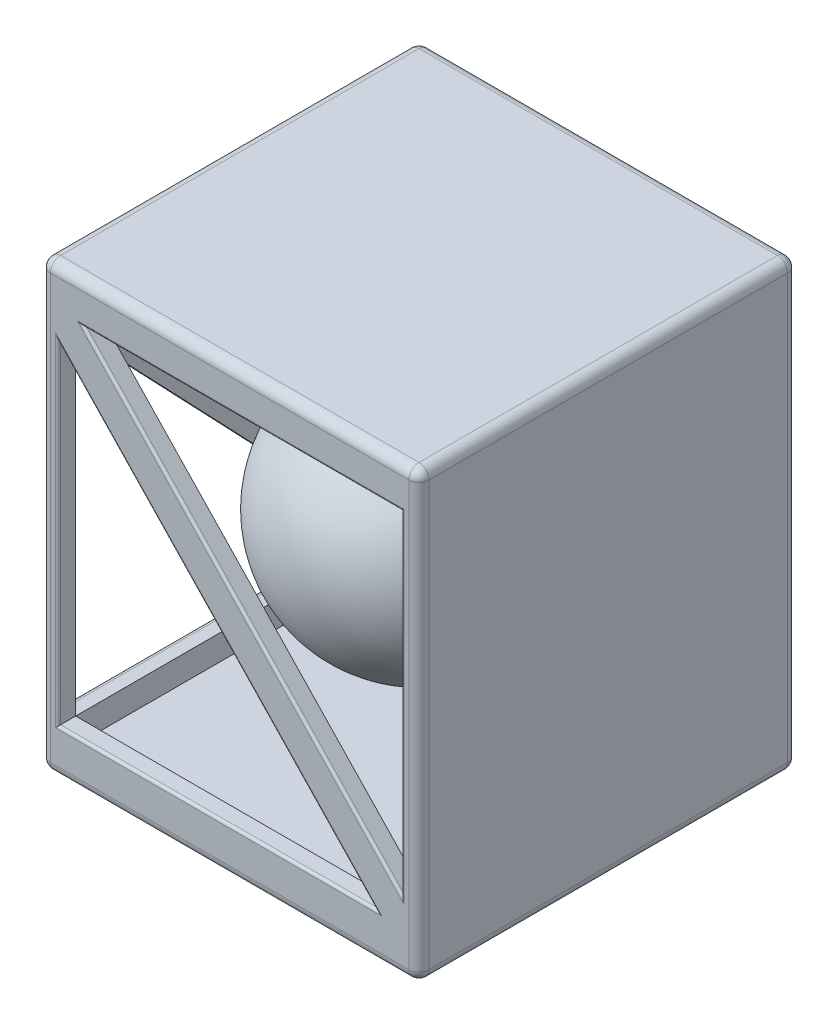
SolidWorks part; units mm, degrees
ref_plane "Front Plane" through (0, 0, 0) normal (0, 0, 1) x (1, 0, 0)
ref_plane "Top Plane" through (0, 0, 0) normal (0, 1, 0) x (1, 0, 0)
ref_plane "Right Plane" through (0, 0, 0) normal (1, 0, 0) x (0, 0, -1)
sketch "Sketch5" plane through (0, 0, 0) normal (0, 1, 0) x (1, 0, 0)
  line L1 (-37.5, 37.5) -> (37.5, 37.5)
  line L2 (-37.5, 37.5) -> (-37.5, -37.5)
  line L3 (-37.5, -37.5) -> (37.5, -37.5)
  line L4 (37.5, 37.5) -> (37.5, -37.5)
  line L5 (-37.5, 37.5) -> (37.5, -37.5) construction
  line L6 (-37.5, -37.5) -> (37.5, 37.5) construction
  point P0 (0, 0)
  dimension "D1" = 75
  dimension "D2" = 75
extrude "Boss-Extrude5" add sketch "Sketch5" along normal blind 4
sketch "Sketch6" plane through (0, 4, 0) normal (0, 1, 0) x (1, 0, 0)
  line L1 (-37.5, 37.5) -> (37.5, 37.5)
  line L2 (-37.5, 37.5) -> (-37.5, -37.5)
  line L3 (-37.5, -37.5) -> (37.5, -37.5)
  line L4 (37.5, 37.5) -> (37.5, -37.5)
  line L5 (-37.5, 37.5) -> (37.5, -37.5) construction
  line L6 (-37.5, -37.5) -> (37.5, 37.5) construction
  line L7 (-34, 34) -> (34, 34)
  line L8 (-34, 34) -> (-34, -34)
  line L9 (-34, -34) -> (34, -34)
  line L10 (34, 34) -> (34, -34)
  line L11 (-34, 34) -> (34, -34) construction
  line L12 (-34, -34) -> (34, 34) construction
  point P0 (0, 0)
  point P7 (0, 0)
  dimension "D1" = 68
  dimension "D2" = 68
extrude "Boss-Extrude7" add sketch "Sketch6" along normal blind 5
sketch "Sketch9" plane through (0, 9, 0) normal (0, 1, 0) x (1, 0, 0)
  line L0 (37.5, -37.5) -> (37.5, 37.5) construction
  line L1 (-37.5, 37.5) -> (-34, 37.5)
  line L2 (-37.5, 37.5) -> (-37.5, 34)
  line L3 (-37.5, 34) -> (-34, 34)
  line L4 (-34, 37.5) -> (-34, 34)
  line L5 (-37.5, 37.5) -> (-34, 34) construction
  line L6 (-37.5, 34) -> (-34, 37.5) construction
  line L7 (-37.5, -37.5) -> (-34, -37.5)
  line L8 (-37.5, -37.5) -> (-37.5, -34)
  line L9 (-37.5, -34) -> (-34, -34)
  line L10 (-34, -37.5) -> (-34, -34)
  line L11 (-37.5, -37.5) -> (-34, -34) construction
  line L12 (-37.5, -34) -> (-34, -37.5) construction
  line L13 (34, -34) -> (37.5, -34)
  line L14 (34, -34) -> (34, -37.5)
  line L15 (34, -37.5) -> (37.5, -37.5)
  line L16 (37.5, -34) -> (37.5, -37.5)
  line L17 (34, -34) -> (37.5, -37.5) construction
  line L18 (34, -37.5) -> (37.5, -34) construction
  line L19 (-37.5, -37.5) -> (37.5, -37.5) construction
  line L21 (34, 34) -> (37.5, 34)
  line L22 (34, 34) -> (34, 37.5)
  line L23 (34, 37.5) -> (37.5, 37.5)
  line L24 (37.5, 34) -> (37.5, 37.5)
  line L25 (34, 34) -> (37.5, 37.5) construction
  line L26 (34, 37.5) -> (37.5, 34) construction
  point P4 (-35.75, 35.75)
  point P11 (-35.75, -35.75)
  point P18 (35.75, -35.75)
  point P28 (35.75, 35.75)
extrude "Boss-Extrude8" add sketch "Sketch9" along normal blind 75
sketch "Sketch10" plane through (0, 84, 0) normal (0, 1, 0) x (1, 0, 0)
  line L1 (-37.5, 37.5) -> (37.5, 37.5)
  line L2 (-37.5, 37.5) -> (-37.5, -37.5)
  line L3 (-37.5, -37.5) -> (37.5, -37.5)
  line L4 (37.5, 37.5) -> (37.5, -37.5)
  line L5 (-37.5, 37.5) -> (37.5, -37.5) construction
  line L6 (-37.5, -37.5) -> (37.5, 37.5) construction
  point P4 (0, 0)
extrude "Boss-Extrude9" add sketch "Sketch10" along normal blind 4
sketch "Sketch11" plane through (0, 88, 0) normal (0, 1, 0) x (1, 0, 0)
  line L1 (-37.5, 37.5) -> (37.5, 37.5)
  line L2 (-37.5, 37.5) -> (-37.5, -37.5)
  line L3 (-37.5, -37.5) -> (37.5, -37.5)
  line L4 (37.5, 37.5) -> (37.5, -37.5)
  line L5 (-37.5, 37.5) -> (37.5, -37.5) construction
  line L6 (-37.5, -37.5) -> (37.5, 37.5) construction
  line L7 (-34, 34) -> (34, 34)
  line L8 (-34, 34) -> (-34, -34)
  line L9 (-34, -34) -> (34, -34)
  line L10 (34, 34) -> (34, -34)
  line L11 (-34, 34) -> (34, -34) construction
  line L12 (-34, -34) -> (34, 34) construction
  point P4 (0, 0)
  point P7 (0, 0)
  dimension "D1" = 68
  dimension "D2" = 68
extrude "Boss-Extrude10" add sketch "Sketch11" against normal blind 4 from offset 4
sketch "Sketch12" plane through (0, 0, 0) normal (1, 0, 0) x (0, 0, -1)
  line L0 (0, 80) -> (0, 9) construction
  line L1 (-34, 80) -> (34, 80) construction
  line L2 (-34, 9) -> (34, 9) construction
  line L3 (0, 69.5) -> (0, 19.5)
  arc A0 (0, 19.5) -> (0, 69.5) centre (0, 44.5) cw
  dimension "D1" = 25
revolve "Revolve1" add sketch "Sketch12" angle 360 about L3
sketch "Sketch13" plane through (37.5, 0, 0) normal (1, 0, 0) x (0, 0, -1)
  line L0 (-34, 80) -> (-29, 80) construction
  line L2 (-34, 80) -> (34, 80) construction
  line L3 (-34, 80) -> (-34, 75) construction
  line L5 (-34, 80) -> (-34, 9) construction
  line L6 (-34, 75) -> (-29, 80) construction
  line L7 (34, 9) -> (29, 9)
  line L8 (-34, 9) -> (34, 9) construction
  line L9 (34, 9) -> (34, 14)
  line L10 (34, 80) -> (34, 9) construction
  line L11 (-34, 75) -> (-34, 80)
  line L12 (-34, 80) -> (-29, 80)
  line L13 (-34, 75) -> (29, 9)
  line L14 (-29, 80) -> (34, 14)
  dimension "D1" = 5
  dimension "D2" = 5
  dimension "D3" = 5
  dimension "D4" = 5
extrude "Boss-Extrude13" add sketch "Sketch13" against normal blind 3.5 separate body
sketch "Sketch15" plane through (0, 0, -37.5) normal (0, 0, -1) x (-1, 0, 0)
  line L0 (-34, 80) -> (-29, 80) construction
  line L1 (-34, 80) -> (34, 80) construction
  line L2 (-34, 80) -> (-34, 75) construction
  line L3 (-34, 80) -> (-34, 9) construction
  line L4 (34, 9) -> (34, 14) construction
  line L5 (34, 80) -> (34, 9) construction
  line L6 (34, 9) -> (29, 9) construction
  line L7 (-34, 9) -> (34, 9) construction
  line L8 (-34, 75) -> (29, 9)
  line L9 (-29, 80) -> (34, 14)
  line L10 (-34, 75) -> (-34, 80)
  line L11 (-34, 80) -> (-29, 80)
  line L12 (34, 14) -> (34, 9)
  line L13 (29, 9) -> (34, 9)
  dimension "D1" = 5
  dimension "D2" = 5
  dimension "D3" = 5
  dimension "D4" = 5
extrude "Boss-Extrude15" add sketch "Sketch15" against normal blind 3.5
sketch "Sketch16" plane through (-37.5, 0, 0) normal (-1, 0, 0) x (0, 0, 1)
  line L0 (-34, 9) -> (-29, 9) construction
  line L1 (-34, 9) -> (34, 9) construction
  line L2 (-34, 9) -> (-34, 14) construction
  line L3 (-34, 80) -> (-34, 9) construction
  line L4 (34, 80) -> (29, 80) construction
  line L5 (-34, 80) -> (34, 80) construction
  line L6 (34, 80) -> (34, 75) construction
  line L8 (34, 80) -> (34, 9) construction
  line L9 (29, 80) -> (-34, 14)
  line L10 (34, 75) -> (-29, 9)
  line L11 (-34, 14) -> (-34, 9)
  line L12 (-34, 9) -> (-29, 9)
  line L13 (29, 80) -> (34, 80)
  line L14 (34, 80) -> (34, 75)
  dimension "D1" = 5
  dimension "D2" = 5
  dimension "D3" = 5
  dimension "D4" = 5
extrude "Boss-Extrude16" add sketch "Sketch16" against normal blind 3.5
sketch "Sketch17" plane through (0, 0, 37.5) normal (0, 0, 1) x (1, 0, 0)
  line L0 (-34, 80) -> (-29, 80) construction
  line L1 (-34, 80) -> (34, 80) construction
  line L2 (-34, 80) -> (-34, 75) construction
  line L3 (-34, 80) -> (-34, 9) construction
  line L4 (34, 9) -> (34, 14)
  line L5 (34, 80) -> (34, 9) construction
  line L6 (34, 9) -> (29, 9) construction
  line L7 (-34, 9) -> (34, 9) construction
  line L8 (-34, 75) -> (29, 9)
  line L9 (-29, 80) -> (34, 14)
  line L10 (-34, 75) -> (-34, 80)
  line L11 (-34, 80) -> (-29, 80)
  line L12 (29, 9) -> (34, 9)
  line L13 (34, 9) -> (34, 14)
  dimension "D1" = 5
  dimension "D2" = 5
  dimension "D3" = 5
  dimension "D4" = 5
extrude "Boss-Extrude17" add sketch "Sketch17" against normal blind 3.5 contours L9 L8 M6 M5 M8 M7
sketch "Sketch19" plane through (37.5, 0, 0) normal (1, 0, 0) x (0, 0, -1)
  line L1 (-34, 80) -> (34, 80)
  line L2 (-34, 80) -> (-34, 9)
  line L3 (-34, 9) -> (34, 9)
  line L4 (34, 80) -> (34, 9)
  line L5 (-34, 80) -> (34, 9) construction
  line L6 (-34, 9) -> (34, 80) construction
  point P4 (0, 44.5)
extrude "Boss-Extrude18" add sketch "Sketch19" against normal blind 3.5
sketch "Sketch20" plane through (-37.5, 0, 0) normal (-1, 0, 0) x (0, 0, 1)
  line L0 (-31.5, 9) -> (34, 77.5) construction
  line L1 (-34, 9) -> (-29, 9) construction
  line L2 (34, 75) -> (34, 80) construction
  text T0 "Engr. Farhan Ali Shah" font "Century Gothic" height in points 12
extrude "Cut-Extrude1" cut sketch "Sketch20" against normal blind 2
fillet "Fillet1" radius 2 1 edges at (-37.5, 44, -37.5)
fillet "Fillet2" radius 2 1 edges at (-37.5, 44, 37.5)
fillet "Fillet3" radius 2 5 edges at (-37.5, 88, 0) (-36.9142, 88, -36.9142) (1, 88, 37.5) (-36.9142, 88, 36.9142) (1, 88, -37.5)
fillet "Fillet4" radius 2 5 edges at (37.5, 43, 37.5) (37.5, 88, 0) (37.5, 43, -37.5) (37.5, 87.4142, -36.9142) (37.5, 87.4142, 36.9142)
fillet "Fillet5" radius 2 8 edges at (-37.5, 0, 0) (-36.9142, 0, -36.9142) (0, 0, 37.5) (-36.9142, 0, 36.9142) (37.5, 0, 0) (0, 0, -37.5) (36.9142, 0, 36.9142) (36.9142, 0, -36.9142)
fillet "Fillet8" radius 1 1 edges at (-37.5, 9, 2.5)
fillet "Fillet9" radius 1 2 edges at (-37.2071, 8.7071, 34) (-37.5, 41.5, 34)
fillet "Fillet10" radius 1 1 edges at (-37.5, 47, -34)
fillet "Fillet11" radius 1 2 edges at (-37.2071, 80, -34.2929) (-37.5, 80, -3)
fillet "Fillet12" radius 0.5 2 edges at (-37.2071, 13.6932, -34.2929) (-37.5, 46.9762, -2.5227)
fillet "Fillet13" radius 0.5 2 edges at (-37.2071, 75.3068, 34.2929) (-37.5, 42.0238, 2.5227)
fillet "Fillet14" radius 0.5 3 edges at (-34, 47, -37.5) (-2.5, 80, -37.5) (-2.5, 47, -37.5)
fillet "Fillet15" radius 0.5 3 edges at (34, 42, -37.5) (2.5, 42, -37.5) (2.5, 9, -37.5)
fillet "Fillet16" radius 0.5 3 edges at (34, 47, 37.5) (2.5, 80, 37.5) (2.5, 47, 37.5)
fillet "Fillet17" radius 0.5 3 edges at (-34, 42, 37.5) (-2.5, 42, 37.5) (-2.5, 9, 37.5)
